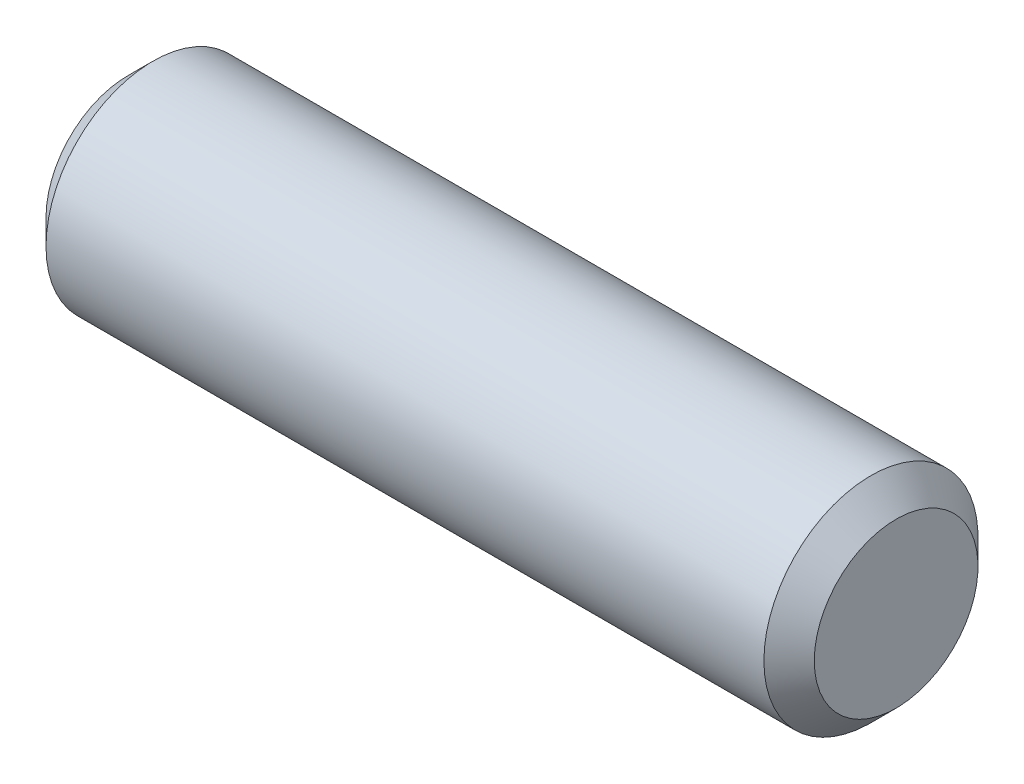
SolidWorks part; units mm, degrees
ref_plane "Front Plane" through (0, 0, 0) normal (0, 0, 1) x (1, 0, 0)
ref_plane "Top Plane" through (0, 0, 0) normal (0, 1, 0) x (1, 0, 0)
ref_plane "Right Plane" through (0, 0, 0) normal (1, 0, 0) x (0, 0, -1)
sketch "Sketch2" plane through (0, 0, 0) normal (0, 0, 1) x (1, 0, 0)
  line L0 (0, 0) -> (0, 0.8255)
  line L1 (0.254, 1.0795) -> (7.493, 1.0795)
  line L2 (7.747, 0.8255) -> (7.747, 0)
  line L3 (0, 0) -> (64276.2524, 0) construction
  line L4 (0, 0) -> (7.747, 0)
  line L5 (7.493, 1.0795) -> (7.747, 0.8255)
  line L6 (0, 0.8255) -> (0.254, 1.0795)
  point P1 (0, 1.0795)
  point P4 (7.747, 1.0795)
  dimension "D1" = 7.747
  dimension "D2" = 1.0795
  dimension "D3" = 0.254
  dimension "D4" = 45
  dimension "D5" = 0.254
  dimension "D6" = 45
revolve "Revolve1" add sketch "Sketch2" angle 360 about L3
